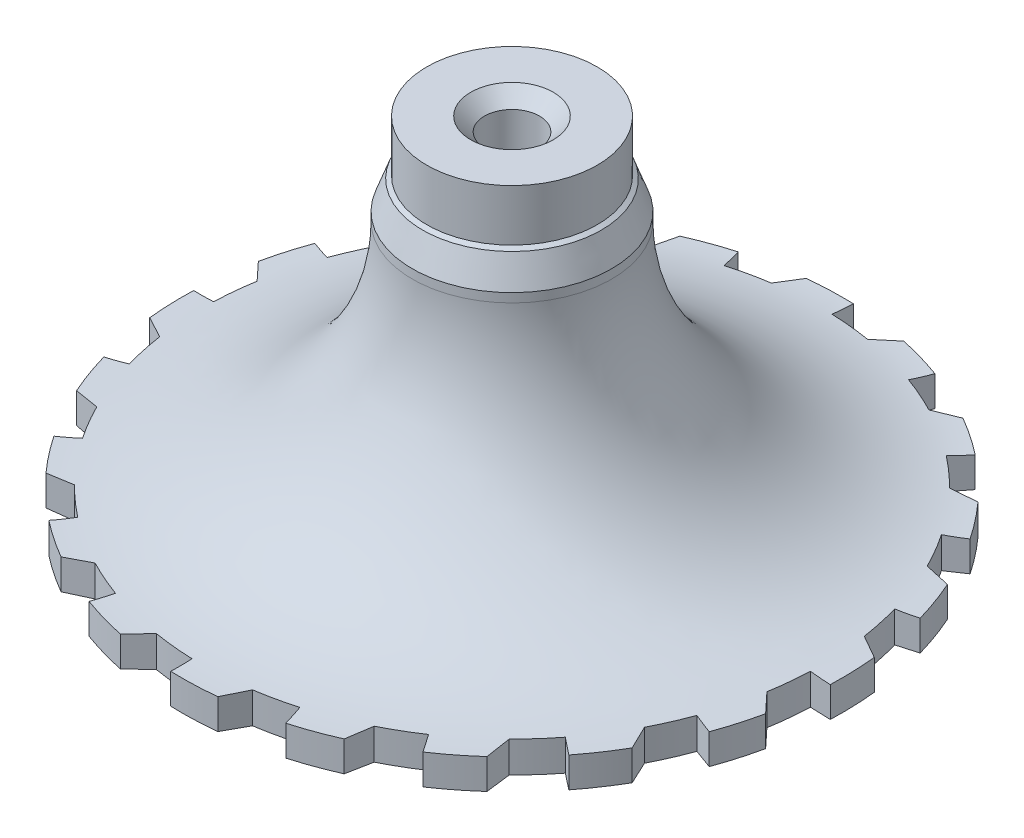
SolidWorks part; units mm, degrees
ref_plane "Front Plane" through (0, 0, 0) normal (0, 0, 1) x (1, 0, 0)
ref_plane "Top Plane" through (0, 0, 0) normal (0, 1, 0) x (1, 0, 0)
ref_plane "Right Plane" through (0, 0, 0) normal (1, 0, 0) x (0, 0, -1)
sketch "Sketch1" plane through (0, 0, 0) normal (0, 0, 1) x (1, 0, 0)
  line L0 (0, 0) -> (0, 36.069) construction
  line L1 (0, 0) -> (34.9923, 0) construction
  line L2 (3.81, 32.512) -> (7.874, 32.512)
  line L3 (7.874, 32.512) -> (7.874, 27.7495)
  line L4 (7.874, 27.7495) -> (8.255, 27.509)
  line L5 (8.255, 27.509) -> (9.2075, 24.892)
  line L6 (9.2075, 24.892) -> (9.2075, 24.0665)
  line L7 (2.54, 31.242) -> (2.54, 0.8814)
  line L8 (30.48, 2.794) -> (30.48, 0)
  line L9 (30.48, 0) -> (24.765, 0)
  line L10 (24.765, 0) -> (24.765, 1.27)
  line L11 (24.765, 1.27) -> (11.1125, 1.27)
  line L12 (11.1125, 1.27) -> (10.7239, 0.8814)
  line L13 (10.7239, 0.8814) -> (2.54, 0.8814)
  line L15 (3.81, 32.512) -> (2.54, 31.242)
  arc A0 (9.2075, 24.0665) -> (30.48, 2.794) centre (30.48, 24.0665) ccw
  dimension "D1" = 60.96
  dimension "D2" = 49.53
  dimension "D3" = 32.512
  dimension "D4" = 1.27
  dimension "D5" = 0.3886
  dimension "D6" = 22.225
  dimension "D7" = 45
  dimension "D8" = 18.415
  dimension "D9" = 16.51
  dimension "D10" = 4.7625
  dimension "D11" = 7.62
  dimension "D12" = 15.748
  dimension "D13" = 5.08
  dimension "D14" = 20
  dimension "D15" = 2.794
  dimension "D16" = 1.27
  dimension "D17" = 45
revolve "Revolve Body" add sketch "Sketch1" angle 360 about L0
sketch "Sketch2" plane through (0, 0, 0) normal (0, 1, 0) x (-1, 0, 0)
  line L0 (0, 0) -> (-31.9917, 11.644) construction
  line L1 (-28.6418, 10.4248) -> (-26.8517, 9.7732)
  line L2 (-26.3755, 15.2762) -> (-25.3771, 13.1352)
  line L3 (0, 0) -> (-34.359, 0) construction
  circle A0 centre (0, 0) radius 30.48 construction
  arc A2 (-26.8517, 9.7732) -> (-25.3771, 13.1352) centre (0, 0) cw
  arc A3 (-28.6418, 10.4248) -> (-26.3755, 15.2762) centre (0, 0) cw
  dimension "D1" = 28.575
  dimension "D2" = 5.334
  dimension "D3" = 45
  dimension "D4" = 20
extrude "Main Tooth" cut sketch "Sketch2" along normal up to next
pattern_circular "CirPattern4" count 20 over 360 about axis through (0, 0, 0) along (0, 1, 0) of "Main Tooth"
ref_plane "Plane1" through (0, 24.0792, 0) normal (0, 1, 0) x (-1, 0, 0)
ref_plane "Plane2" through (0, 8.89, 0) normal (0, 1, 0) x (-1, 0, 0)
ref_plane "Plane3" through (0, 2.794, 0) normal (0, 1, 0) x (-1, 0, 0)
sketch "Tall Blade Profile1" plane through (0, 24.0792, 0) normal (0, 1, 0) x (-1, 0, 0)
  line L0 (0, 0) -> (-20.8543, -5.5879) construction
  line L1 (0, 0) -> (-35.7541, 0) construction
  line L3 (-8.8426, -2.5666) -> (-20.805, -5.7719)
  line L4 (0.0493, -0.184) -> (-20.805, -5.7719) construction
  line L5 (-8.9412, -2.1986) -> (-20.9036, -5.4039)
  circle A2 centre (0, 0) radius 21.59 construction
  arc A3 (-8.9412, -2.1986) -> (-8.8426, -2.5666) centre (0, 0) ccw
  arc A5 (-20.805, -5.7719) -> (-20.9036, -5.4039) centre (0, 0) cw
  circle A9 centre (0, 0) radius 9.2075 construction
  dimension "D1" = 43.18
  dimension "D2" = 15
  dimension "D3" = 0.381
  dimension "D4" = 0.1905
sketch "Tall Blade Profile3" plane through (35.4794, 2.794, 12.9328) normal (0, -1, 0) x (-1, 0, 0)
  line L1 (26.8272, 9.7837) -> (6.8376, 2.5081)
  line L3 (26.5325, 10.7577) -> (6.506, 3.4686)
  line L5 (26.8272, 9.7837) -> (35.4794, 12.9328) construction
  arc A0 (26.5325, 10.7577) -> (26.8272, 9.7837) centre (35.4794, 12.9328) ccw
  circle A1 centre (35.4794, 12.9328) radius 9.2075 construction
  circle A2 centre (35.4794, 12.9328) radius 30.48 construction
  arc A3 (9.1039, -2.3434) -> (11.4608, -5.8325) centre (35.4794, 12.9328) ccw construction
  arc A4 (6.506, 3.4686) -> (6.8376, 2.5081) centre (35.4794, 12.9328) ccw
  dimension "D1" = 1.016
sketch "Tall Blade Profile2" plane through (-0.4538, 8.89, -1.1826) normal (0, -1, 0) x (1, 0, 0)
  line L1 (29.1388, 11.488) -> (9.1486, 4.2122) construction
  line L2 (9.4006, 3.3578) -> (29.4272, 10.6469) construction
  line L3 (29.1388, 11.488) -> (9.1486, 4.2122)
  line L4 (29.3875, 10.7676) -> (9.3696, 3.4817)
  circle A1 centre (0.4538, 1.1826) radius 30.48 construction
  arc A2 (9.1486, 4.2122) -> (9.3696, 3.4817) centre (0.4538, 1.1826) cw
  arc A3 (26.8293, 16.4589) -> (24.4723, 19.948) centre (0.4538, 1.1826) ccw construction
  arc A4 (29.3875, 10.7676) -> (29.1388, 11.488) centre (0.4538, 1.1826) ccw
  arc A5 (9.4006, 3.3578) -> (9.106, 4.3318) centre (0.4538, 1.1826) ccw construction
  dimension "D1" = 0.762
  dimension "D2" = 0.127
sketch3d "Tall Guide Curve1"
  line L0 (28.6418, 2.794, 10.4248) -> (28.685, 8.89, 10.3053)
  spline S0 degree 3 poles (20.9036, 24.0792, -5.4039) (20.8398, 21.2432, -1.4629) (20.7282, 16.2921, 5.4173) (26.3033, 11.1056, 8.8422) (28.685, 8.89, 10.3053) knots 0 0 0 0 0.5728 1 1 1 1
sketch3d "Tall Guide Curve2"
  spline S0 degree 3 poles (8.9412, 24.0792, -2.1986) (7.996, 21.894, -0.8152) (7.0509, 19.7088, 0.5682) (6.5667, 14.6457, 2.1121) (7.6308, 11.7678, 2.5708) (8.6948, 8.89, 3.0295) knots 0 0 0 0 0.473245 0.473245 1 1 1 1
  spline S1 degree 3 poles (8.6522, 2.794, 3.1492) (8.6664, 4.826, 3.1093) (8.6806, 6.858, 3.0694) (8.6948, 8.89, 3.0295) knots 0 0 0 0 1 1 1 1
ref_plane "Plane4" through (0, 15.8242, 0) normal (0, 1, 0) x (-1, 0, 0)
sketch "Short Blade Profile1" plane through (0, 15.8242, 0) normal (0, 1, 0) x (-1, 0, 0)
  line L0 (0, 0) -> (-21.262, -3.7491) construction
  line L1 (0, 0) -> (-35.7541, 0) construction
  line L3 (-9.0326, -1.7861) -> (-21.2289, -3.9367)
  line L4 (0.0331, -0.1876) -> (-21.2289, -3.9367) construction
  line L5 (-9.0988, -1.4109) -> (-21.2951, -3.5615)
  circle A0 centre (0, 0) radius 9.2075 construction
  circle A2 centre (0, 0) radius 21.59 construction
  arc A3 (-9.0988, -1.4109) -> (-9.0326, -1.7861) centre (0, 0) ccw
  arc A5 (-21.2289, -3.9367) -> (-21.2951, -3.5615) centre (0, 0) cw
  dimension "D1" = 43.18
  dimension "D2" = 10
  dimension "D3" = 0.381
  dimension "D4" = 0.1905
sketch "Short Blade Profile2" plane through (-0.4538, 8.89, -1.1826) normal (0, -1, 0) x (1, 0, 0)
  line L0 (9.6589, 1.3889) -> (30.9261, 1.8655) construction
  line L1 (30.9152, 2.2464) -> (9.6425, 1.7697) construction
  line L2 (9.6589, 1.3889) -> (0.4538, 1.1826) construction
  line L3 (30.9152, 2.2464) -> (9.6425, 1.7697)
  line L4 (30.9323, 1.4846) -> (9.6596, 1.0079)
  arc A0 (30.7711, -1.9618) -> (30.9152, 2.2464) centre (0.4538, 1.1826) ccw construction
  circle A1 centre (0.4538, 1.1826) radius 9.2075 construction
  arc A2 (9.6425, 1.7697) -> (9.6596, 1.0079) centre (0.4538, 1.1826) cw
  arc A4 (30.9323, 1.4846) -> (30.9152, 2.2464) centre (0.4538, 1.1826) ccw
  dimension "D1" = 0.762
  dimension "D2" = 0.381
sketch "Short Blade Profile3" plane through (35.4794, 2.794, 12.9328) normal (0, -1, 0) x (-1, 0, 0)
  line L0 (5.018, 11.8691) -> (26.2906, 12.3458) construction
  line L1 (26.2906, 12.3458) -> (5.018, 11.8691)
  line L3 (26.2819, 13.3619) -> (4.9994, 12.8849)
  arc A0 (26.2819, 13.3619) -> (26.2906, 12.3458) centre (35.4794, 12.9328) ccw
  arc A4 (4.9994, 12.8849) -> (5.018, 11.8691) centre (35.4794, 12.9328) ccw
  circle A5 centre (35.4794, 12.9328) radius 9.2075 construction
  dimension "D1" = 1.016
sketch3d "Short Guide Curve1"
  spline S0 degree 3 poles (21.2951, 15.8242, -3.5615) (23.4793, 13.9967, -1.2881) (25.6635, 12.1692, 0.9853) (28.6272, 9.8578, 1.0253) (29.5443, 9.3739, 1.0445) (30.4614, 8.89, 1.0637) knots 0 0 0 0 0.768116 0.768116 1 1 1 1
  spline S1 degree 3 poles (30.4614, 2.794, 1.0637) (30.4614, 4.826, 1.0637) (30.4614, 6.858, 1.0637) (30.4614, 8.89, 1.0637) knots 0 0 0 0 1 1 1 1
sketch3d "Short Guide Curve2"
  line L0 (9.1888, 2.794, 0.587) -> (9.1888, 8.89, 0.587)
  spline S0 degree 3 poles (9.0988, 15.8242, -1.4109) (8.9503, 14.2115, -0.4211) (8.8019, 12.5988, 0.5687) (8.8004, 10.2874, 0.5938) (9.1888, 9.6116, 0.587) (9.1888, 8.89, 0.587) knots 0 0 0 0 0.716676 0.716676 1 1 1 1
sketch "Blade Trim Sketch" plane through (0, 0, 0) normal (0, 0, 1) x (1, 0, 0)
  line L0 (0, 0) -> (0, 38.116) construction
  line L3 (19.939, 24.384) -> (21.1204, 16.925)
  line L8 (19.939, 24.384) -> (30.734, 24.384)
  line L9 (30.5281, 8.89) -> (30.734, 8.89)
  line L10 (30.734, 8.89) -> (30.734, 24.384)
  line L11 (28.6418, 0) -> (29.8052, 0) construction
  arc A0 (21.1204, 16.925) -> (30.5281, 8.89) centre (30.5281, 18.415) ccw
  dimension "D1" = 9.525
  dimension "D2" = 9
  dimension "D3" = 8.89
  dimension "D4" = 19.939
  dimension "D5" = 10.795
  dimension "D6" = 24.384
